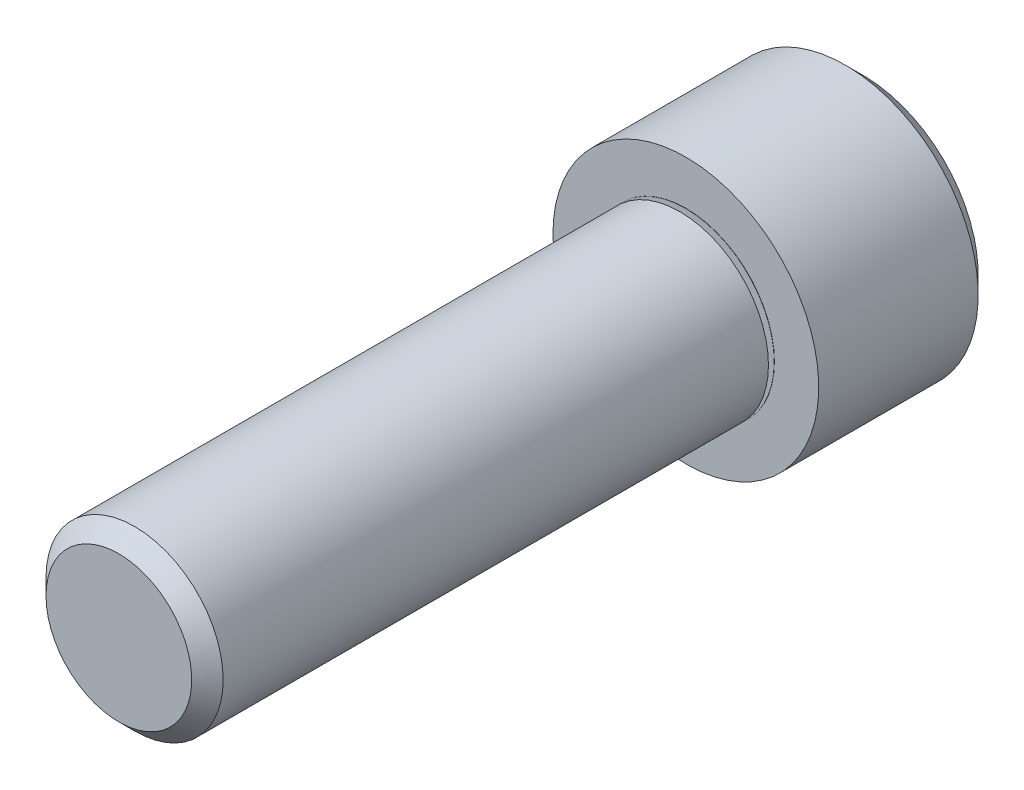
SolidWorks part; units mm, degrees
ref_plane "Front" through (0, 0, 0) normal (0, 0, 1) x (1, 0, 0)
ref_plane "Top" through (0, 0, 0) normal (0, 1, 0) x (1, 0, 0)
ref_plane "Right" through (0, 0, 0) normal (1, 0, 0) x (0, 0, -1)
sketch "Logo3_Revol_Axis" plane through (0, 0, 0) normal (0, 1, 0) x (1, 0, 0)
  line L0 (0, -43.5172) -> (0, 43.5172) construction
sketch "Logo3_bib1" plane through (0, 0, 0) normal (0, -1, 0) x (-1, 0, 0)
  line L0 (0, -25.4) -> (0, 7.9375)
  line L1 (0, 7.9375) -> (5.1594, 7.9375)
  line L2 (5.9531, 7.1437) -> (5.9531, 0)
  line L3 (5.9531, 0) -> (3.9688, 0)
  line L4 (3.9688, 0) -> (3.9688, -0.01)
  line L5 (3.9688, -24.6951) -> (3.2639, -25.4)
  line L6 (3.2639, -25.4) -> (0, -25.4)
  line L7 (3.9688, -0.01) -> (3.3773, -0.01)
  line L8 (3.3705, -0.0488) -> (3.9688, -0.2665)
  line L9 (3.9688, -0.2665) -> (3.9688, -24.6951)
  line L10 (0, 10.5852) -> (0, -63.2873) construction
  line L11 (5.1594, 7.9375) -> (5.9531, 7.1437)
  arc A1 (3.3773, -0.01) -> (3.3705, -0.0488) centre (3.3773, -0.03) ccw
  point P17 (3.2639, -0.01)
  point P19 (5.9531, 7.9375)
revolve "Revolve1" add sketch "Logo3_bib1" angle 360 about L10
sketch "Logo3_bib2" plane through (0, 0, -7.9375) normal (0, 0, -1) x (1, 0, 0)
  line L1 (3.6662, 0) -> (1.8331, 3.175)
  line L2 (1.8331, 3.175) -> (-1.8331, 3.175)
  line L3 (-1.8331, 3.175) -> (-3.6662, 0)
  line L4 (-3.6662, 0) -> (-1.8331, -3.175)
  line L5 (-1.8331, -3.175) -> (1.8331, -3.175)
  line L6 (1.8331, -3.175) -> (3.6662, 0)
  circle A0 centre (0, 0) radius 3.175 construction
  dimension "Logo3_c1" = 6.35
extrude "Cut-Extrude1" cut sketch "Logo3_bib2" against normal blind 3.9688
equation "\"DIA2@Logo3_bib1\" = \"Logo3_d1-pas@Logo3_bib1\""
equation "\"LGT1@Logo3_bib1\" = \"Logo3_d1@Logo3_bib1\""
equation "\"D1@Cut-Extrude1\" = \"Logo3_d1@Logo3_bib1\"/2."
equation "\"D2@Cosmetic Thread1\" = \"Logo3_d1-pas@Logo3_bib1\""
equation "\"D5@Logo3_bib1\"=\"Logo3_d1@Logo3_bib1\"*.1"
